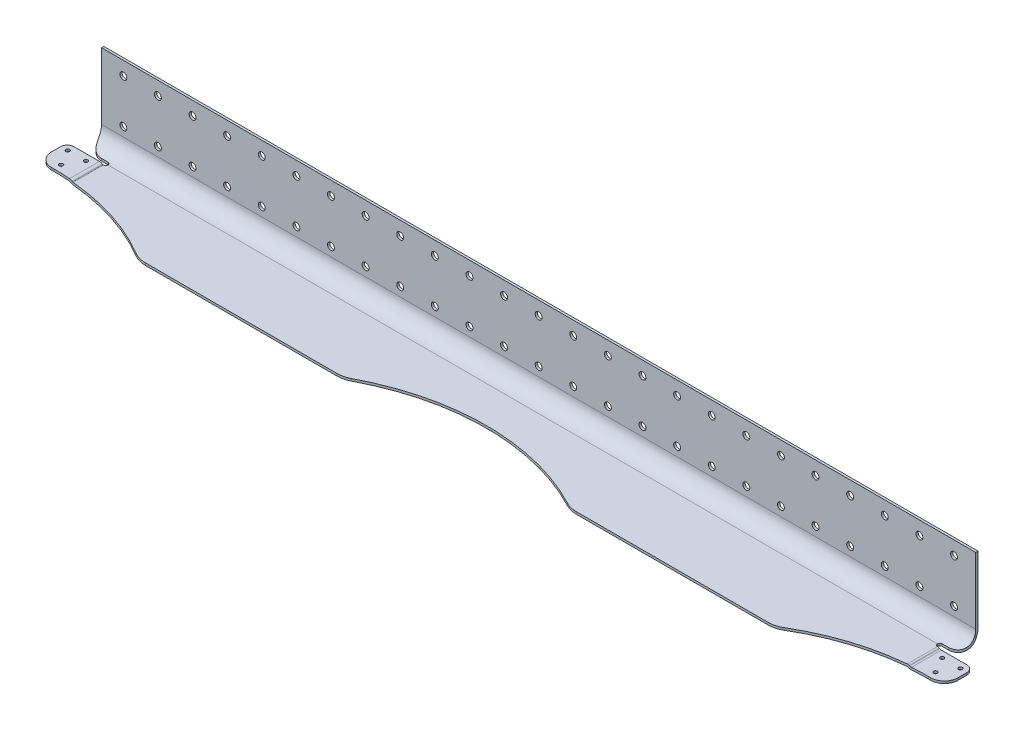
SolidWorks part; units mm, degrees
ref_plane "Front Plane" through (0, 0, 0) normal (1, 0, 0) x (0, 1, 0)
ref_plane "Top Plane" through (0, 0, 0) normal (0, 0, 1) x (0, 1, 0)
ref_plane "Right Plane" through (0, 0, 0) normal (0, 1, 0) x (-1, 0, 0)
sketch "sk 5dia hole pat" plane through (0, 0, 0) normal (0, 0, 1) x (0, 1, 0)
  line L4 (-30.48, -48.26) -> (30.48, -48.26) construction
  point P3 (0, -48.26)
  circle B0 centre (30.48, -579.12) radius 4.826
  circle B1 centre (1188.72, 579.12) radius 4.826
  circle B2 centre (78.74, -579.12) radius 4.826
  circle B3 centre (127, -579.12) radius 4.826
  circle B4 centre (175.26, -579.12) radius 4.826
  circle B5 centre (223.52, -579.12) radius 4.826
  circle B6 centre (271.78, -579.12) radius 4.826
  circle B7 centre (320.04, -579.12) radius 4.826
  circle B8 centre (368.3, -579.12) radius 4.826
  circle B9 centre (416.56, -579.12) radius 4.826
  circle B10 centre (464.82, -579.12) radius 4.826
  circle B11 centre (513.08, -579.12) radius 4.826
  circle B12 centre (561.34, -579.12) radius 4.826
  circle B13 centre (609.6, -579.12) radius 4.826
  circle B14 centre (657.86, -579.12) radius 4.826
  circle B15 centre (706.12, -579.12) radius 4.826
  circle B16 centre (754.38, -579.12) radius 4.826
  circle B17 centre (802.64, -579.12) radius 4.826
  circle B18 centre (850.9, -579.12) radius 4.826
  circle B19 centre (899.16, -579.12) radius 4.826
  circle B20 centre (947.42, -579.12) radius 4.826
  circle B21 centre (995.68, -579.12) radius 4.826
  circle B22 centre (1043.94, -579.12) radius 4.826
  circle B23 centre (1092.2, -579.12) radius 4.826
  circle B24 centre (1140.46, -579.12) radius 4.826
  circle B25 centre (1188.72, -579.12) radius 4.826
  circle B26 centre (30.48, -530.86) radius 4.826
  circle B27 centre (30.48, -482.6) radius 4.826
  circle B28 centre (30.48, -434.34) radius 4.826
  circle B29 centre (30.48, -386.08) radius 4.826
  circle B30 centre (30.48, -337.82) radius 4.826
  circle B31 centre (30.48, -289.56) radius 4.826
  circle B32 centre (30.48, -241.3) radius 4.826
  circle B33 centre (30.48, -193.04) radius 4.826
  circle B34 centre (30.48, -144.78) radius 4.826
  circle B35 centre (30.48, -96.52) radius 4.826
  circle B36 centre (30.48, -48.26) radius 4.826
  circle B37 centre (30.48, 0) radius 4.826
  circle B38 centre (30.48, 48.26) radius 4.826
  circle B39 centre (30.48, 96.52) radius 4.826
  circle B40 centre (30.48, 144.78) radius 4.826
  circle B41 centre (30.48, 193.04) radius 4.826
  circle B42 centre (30.48, 241.3) radius 4.826
  circle B43 centre (30.48, 289.56) radius 4.826
  circle B44 centre (30.48, 337.82) radius 4.826
  circle B45 centre (30.48, 386.08) radius 4.826
  circle B46 centre (30.48, 434.34) radius 4.826
  circle B47 centre (30.48, 482.6) radius 4.826
  circle B48 centre (30.48, 530.86) radius 4.826
  circle B49 centre (30.48, 579.12) radius 4.826
  circle B50 centre (1140.46, 579.12) radius 4.826
  circle B51 centre (1092.2, 579.12) radius 4.826
  circle B52 centre (1043.94, 579.12) radius 4.826
  circle B53 centre (995.68, 579.12) radius 4.826
  circle B54 centre (947.42, 579.12) radius 4.826
  circle B55 centre (899.16, 579.12) radius 4.826
  circle B56 centre (850.9, 579.12) radius 4.826
  circle B57 centre (802.64, 579.12) radius 4.826
  circle B58 centre (754.38, 579.12) radius 4.826
  circle B59 centre (706.12, 579.12) radius 4.826
  circle B60 centre (657.86, 579.12) radius 4.826
  circle B61 centre (609.6, 579.12) radius 4.826
  circle B62 centre (561.34, 579.12) radius 4.826
  circle B63 centre (513.08, 579.12) radius 4.826
  circle B64 centre (464.82, 579.12) radius 4.826
  circle B65 centre (416.56, 579.12) radius 4.826
  circle B66 centre (368.3, 579.12) radius 4.826
  circle B67 centre (320.04, 579.12) radius 4.826
  circle B68 centre (271.78, 579.12) radius 4.826
  circle B69 centre (223.52, 579.12) radius 4.826
  circle B70 centre (175.26, 579.12) radius 4.826
  circle B71 centre (127, 579.12) radius 4.826
  circle B72 centre (78.74, 579.12) radius 4.826
  circle B73 centre (1188.72, 530.86) radius 4.826
  circle B74 centre (1188.72, 482.6) radius 4.826
  circle B75 centre (1188.72, 434.34) radius 4.826
  circle B76 centre (1188.72, 386.08) radius 4.826
  circle B77 centre (1188.72, 337.82) radius 4.826
  circle B78 centre (1188.72, 289.56) radius 4.826
  circle B79 centre (1188.72, 241.3) radius 4.826
  circle B80 centre (1188.72, 193.04) radius 4.826
  circle B81 centre (1188.72, 144.78) radius 4.826
  circle B82 centre (1188.72, 96.52) radius 4.826
  circle B83 centre (1188.72, 48.26) radius 4.826
  circle B84 centre (1188.72, 0) radius 4.826
  circle B85 centre (1188.72, -48.26) radius 4.826
  circle B86 centre (1188.72, -96.52) radius 4.826
  circle B87 centre (1188.72, -144.78) radius 4.826
  circle B88 centre (1188.72, -193.04) radius 4.826
  circle B89 centre (1188.72, -241.3) radius 4.826
  circle B90 centre (1188.72, -289.56) radius 4.826
  circle B91 centre (1188.72, -337.82) radius 4.826
  circle B92 centre (1188.72, -386.08) radius 4.826
  circle B93 centre (1188.72, -434.34) radius 4.826
  circle B94 centre (1188.72, -482.6) radius 4.826
  circle B95 centre (1188.72, -530.86) radius 4.826
  line B96 (609.6, -579.12) -> (609.6, -504.12) construction
  line B97 (30.48, 0) -> (105.48, 0) construction
  circle B98 centre (-30.48, 579.12) radius 4.826
  circle B99 centre (-175.26, -579.12) radius 4.826
  circle B100 centre (-127, -579.12) radius 4.826
  circle B101 centre (-30.48, -579.12) radius 4.826
  circle B102 centre (-1188.72, 96.52) radius 4.826
  circle B103 centre (-127, 579.12) radius 4.826
  circle B104 centre (-464.82, 579.12) radius 4.826
  circle B105 centre (-513.08, 579.12) radius 4.826
  circle B106 centre (-706.12, 579.12) radius 4.826
  circle B107 centre (-754.38, 579.12) radius 4.826
  circle B108 centre (-899.16, 579.12) radius 4.826
  circle B109 centre (-30.48, 530.86) radius 4.826
  circle B110 centre (-30.48, 482.6) radius 4.826
  circle B111 centre (-30.48, 434.34) radius 4.826
  circle B112 centre (-30.48, 386.08) radius 4.826
  circle B113 centre (-30.48, 337.82) radius 4.826
  circle B114 centre (-30.48, 289.56) radius 4.826
  circle B115 centre (-30.48, 241.3) radius 4.826
  circle B116 centre (-30.48, 193.04) radius 4.826
  circle B117 centre (-30.48, 144.78) radius 4.826
  circle B118 centre (-30.48, 96.52) radius 4.826
  circle B119 centre (-30.48, 48.26) radius 4.826
  circle B120 centre (-30.48, 0) radius 4.826
  circle B121 centre (-30.48, -48.26) radius 4.826
  circle B122 centre (-30.48, -96.52) radius 4.826
  circle B123 centre (-30.48, -144.78) radius 4.826
  circle B124 centre (-30.48, -241.3) radius 4.826
  circle B125 centre (-30.48, -289.56) radius 4.826
  circle B126 centre (-30.48, -337.82) radius 4.826
  circle B127 centre (-30.48, -386.08) radius 4.826
  circle B128 centre (-30.48, -434.34) radius 4.826
  circle B129 centre (-30.48, -482.6) radius 4.826
  circle B130 centre (-30.48, -530.86) radius 4.826
  line B131 (-1188.72, 0) -> (-1113.72, 0) construction
  dimension "D1" = 60.96
sketch_block_instance "5dia hole pat-1"
sketch_block "5dia hole pat" parameters "D1"=9.652, "D2"=9.652, "D3"=75
sketch_block_instance "5dia hole pat-2"
sketch "sk 47.986in pnl" plane through (0, 0, 0) normal (0, 0, 1) x (0, 1, 0)
  line B0 (0.1778, 0) -> (1219.0222, 0) construction
  line B1 (0.1778, 609.4222) -> (1219.0222, 609.4222)
  line B2 (0.1778, 609.4222) -> (0.1778, -609.4222)
  line B3 (0.1778, -609.4222) -> (1219.0222, -609.4222)
  line B4 (1219.0222, 609.4222) -> (1219.0222, -609.4222)
  line B5 (609.6, 609.4222) -> (609.6, -609.4222) construction
  dimension "D1" = 30.3022
sketch_block_instance "47.986in pnl-1"
sketch_block "47.986in pnl" parameters "D1"=1218.8444, "D2"=1218.8444
sketch "sk main body" plane through (0, 0, 0) normal (1, 0, 0) x (0, 1, 0)
  line L0 (49.53, 0) -> (-43.18, 0)
  line L1 (-68.58, 25.4) -> (-68.58, 158.75)
  line L2 (-43.18, 184.15) -> (-7.62, 184.15)
  line L3 (-26.67, 213.8401) -> (-26.67, 147.2198) construction
  line L4 (49.53, 3.175) -> (-43.18, 3.175)
  line L5 (-65.405, 25.4) -> (-65.405, 158.75)
  line L6 (-43.18, 180.975) -> (-7.62, 180.975)
  line L7 (-7.62, 184.15) -> (-7.62, 180.975)
  line L8 (49.53, 3.175) -> (49.53, 0)
  line L9 (670.3644, 0) -> (-670.3644, 0) construction
  arc A0 (-43.18, 0) -> (-68.58, 25.4) centre (-43.18, 25.4) cw
  arc A1 (-68.58, 158.75) -> (-43.18, 184.15) centre (-43.18, 158.75) cw
  arc A2 (-43.18, 3.175) -> (-65.405, 25.4) centre (-43.18, 25.4) cw
  arc A3 (-65.405, 158.75) -> (-43.18, 180.975) centre (-43.18, 158.75) cw
  dimension "D2" = 25.4
  dimension "D1" = 19.05
  dimension "D3" = 12.7
  dimension "D4" = 16.51
  dimension "D5" = 19.05
  dimension "D7" = 177.8
  dimension "D6" = 3.175
extrude "main body" add sketch "sk main body" along normal mid plane 1218.8444
sketch "sk upper holes" plane through (0, 0, 184.15) normal (0, 0, 1) x (1, 0, 0)
  line L0 (-609.4222, 0.1778) -> (-609.4222, 1219.0222) construction
  line L1 (609.4222, 0.1778) -> (609.4222, 1219.0222) construction
  line L2 (609.4222, -7.62) -> (-609.4222, -7.62) construction
  circle A2 centre (-342.9, -26.67) radius 16.51 construction
  circle A3 centre (-266.7, -26.67) radius 16.51 construction
  circle A4 centre (266.7, -26.67) radius 16.51 construction
  circle A5 centre (342.9, -26.67) radius 16.51 construction
  line B0 (-342.9, -26.67) -> (-266.7, -26.67) construction
  circle B1 centre (-342.9, -26.67) radius 7.1438
  circle B2 centre (-266.7, -26.67) radius 7.1438
  line B3 (266.7, -26.67) -> (342.9, -26.67) construction
  circle B4 centre (266.7, -26.67) radius 7.1438
  circle B5 centre (342.9, -26.67) radius 7.1438
  dimension "D1" = 304.8
  dimension "D2" = 304.8
  dimension "D6" = 33.02
  dimension "D7" = 33.02
  dimension "D8" = 33.02
  dimension "D9" = 33.02
  dimension "D3" = 304.6222
  dimension "D4" = 304.6222
  dimension "D5" = 19.05
sketch_block_instance "Upper bolt holes-1"
sketch_block "Upper bolt holes" parameters "D1"=14.2875, "D2"=14.2875, "D3"=76.2
sketch_block_instance "Upper bolt holes-2"
sketch "Sketch6" plane through (0, 0, 184.15) normal (0, 0, 1) x (1, 0, 0)
  line L0 (-371.4962, -43.18) -> (-304.8, 72.3411)
  line L1 (609.4222, -43.18) -> (-609.4222, -43.18) construction
  line L2 (-304.8, 72.3411) -> (-238.1038, -43.18)
  line L3 (-371.4962, -43.18) -> (-638.8127, -43.18)
  line L4 (-638.8127, -43.18) -> (-638.8127, 115.8831)
  line L6 (238.1038, -43.18) -> (304.8, 72.3411)
  line L7 (304.8, 72.3411) -> (371.4962, -43.18)
  line L8 (371.4962, -43.18) -> (645.1619, -43.18)
  line L9 (645.1619, -43.18) -> (645.1619, 115.8831)
  line L10 (-238.1038, -43.18) -> (238.1038, -43.18)
  line L11 (-638.8127, 115.8831) -> (645.1619, 115.8831)
  circle A0 centre (-342.9, -26.67) radius 16.51 construction
  circle A1 centre (-266.7, -26.67) radius 16.51 construction
  circle A2 centre (342.9, -26.67) radius 16.51 construction
  circle A3 centre (266.7, -26.67) radius 16.51 construction
  dimension "D1" = 60
  dimension "D2" = 60
  dimension "D3" = 60
  dimension "D4" = 60
extrude "Upper tabs" cut sketch "Sketch6" against normal blind 10
sketch "Sketch7" plane through (0, 0, 0) normal (0, 1, 0) x (-1, 0, 0)
  line L0 (-238.1038, 180.975) -> (-238.1038, 196.2087)
  line L4 (-238.1038, 196.2087) -> (238.1038, 196.2087)
  line L5 (238.1038, 196.2087) -> (238.1038, 180.975)
  line L6 (-609.4222, 25.4) -> (609.4222, 25.4) construction
  arc A2 (-238.1038, 180.975) -> (238.1038, 180.975) centre (0, 399.136) ccw
  point P2 (0, 76.2)
  dimension "D1" = 50.8
extrude "Side Mid curve" cut sketch "Sketch7" against normal through all
sketch "5dia hole for part" plane through (0, 0, 0) normal (0, 0, 1) x (0, 1, 0)
  circle A0 centre (-30.48, -579.12) radius 4.826
  circle A1 centre (30.48, -579.12) radius 4.826
  circle A2 centre (-30.48, -579.12) radius 4.826 construction
  circle A3 centre (30.48, -579.12) radius 4.826 construction
  circle A4 centre (-30.48, -530.86) radius 4.826
  circle A5 centre (30.48, -530.86) radius 4.826
  circle A6 centre (-30.48, -482.6) radius 4.826
  circle A7 centre (30.48, -482.6) radius 4.826
  circle A8 centre (-30.48, -434.34) radius 4.826
  circle A9 centre (30.48, -434.34) radius 4.826
  circle A10 centre (-30.48, -386.08) radius 4.826
  circle A11 centre (30.48, -386.08) radius 4.826
  circle A12 centre (-30.48, -337.82) radius 4.826
  circle A13 centre (30.48, -337.82) radius 4.826
  circle A14 centre (-30.48, -289.56) radius 4.826
  circle A15 centre (30.48, -289.56) radius 4.826
  circle A16 centre (-30.48, -241.3) radius 4.826
  circle A17 centre (30.48, -241.3) radius 4.826
  circle A18 centre (-30.48, -193.04) radius 4.826
  circle A19 centre (30.48, -193.04) radius 4.826
  circle A20 centre (-30.48, -144.78) radius 4.826
  circle A21 centre (30.48, -144.78) radius 4.826
  circle A22 centre (-30.48, -96.52) radius 4.826
  circle A23 centre (30.48, -96.52) radius 4.826
  circle A24 centre (-30.48, -48.26) radius 4.826
  circle A25 centre (30.48, -48.26) radius 4.826
  circle A26 centre (-30.48, 0) radius 4.826
  circle A27 centre (30.48, 0) radius 4.826
  circle A28 centre (-30.48, 48.26) radius 4.826
  circle A29 centre (30.48, 48.26) radius 4.826
  circle A30 centre (-30.48, 96.52) radius 4.826
  circle A31 centre (30.48, 96.52) radius 4.826
  circle A32 centre (-30.48, 144.78) radius 4.826
  circle A33 centre (30.48, 144.78) radius 4.826
  circle A34 centre (-30.48, 193.04) radius 4.826
  circle A35 centre (30.48, 193.04) radius 4.826
  circle A36 centre (-30.48, 241.3) radius 4.826
  circle A37 centre (30.48, 241.3) radius 4.826
  circle A38 centre (-30.48, 289.56) radius 4.826
  circle A39 centre (30.48, 289.56) radius 4.826
  circle A40 centre (-30.48, 337.82) radius 4.826
  circle A41 centre (30.48, 337.82) radius 4.826
  circle A42 centre (-30.48, 386.08) radius 4.826
  circle A43 centre (30.48, 386.08) radius 4.826
  circle A44 centre (-30.48, 434.34) radius 4.826
  circle A45 centre (30.48, 434.34) radius 4.826
  circle A46 centre (-30.48, 482.6) radius 4.826
  circle A47 centre (30.48, 482.6) radius 4.826
  circle A48 centre (-30.48, 530.86) radius 4.826
  circle A49 centre (30.48, 530.86) radius 4.826
  circle A50 centre (-30.48, 579.12) radius 4.826
  circle A51 centre (30.48, 579.12) radius 4.826
  dimension "D1" = 25
extrude "Holes Bot" cut sketch "5dia hole for part" along normal blind 10
extrude "Holes Top" cut sketch "sk upper holes" against normal blind 10
ref_plane "Tab Lower pln" through (0, 0, 25.4) normal (0, 0, 1) x (0, 1, 0)
sketch "sk Rivet holes" plane through (0, 0, 0) normal (0, 1, 0) x (-1, 0, 0)
  line L1 (609.4222, 0) -> (609.4222, 3.175) construction
  line L3 (64.9605, 25.4) -> (-64.9605, 25.4) construction
  line L5 (-609.4222, 25.4) -> (-609.4222, 158.75) construction
  circle A0 centre (622.3, 37.4) radius 10 construction
  circle A1 centre (609.6, 59.397) radius 10 construction
  circle A2 centre (596.9, 37.4) radius 10 construction
  circle A3 centre (-609.6, 59.397) radius 10 construction
  circle A4 centre (-596.9, 37.4) radius 10 construction
  circle A6 centre (-622.3, 37.4) radius 10 construction
  point P5 (622.3, 34.8092)
  point P9 (622.3, 27.4)
  point P20 (632.3, 37.4)
  point P21 (-632.3, 37.4)
  point P22 (586.9, 37.4)
  point P23 (-586.9, 37.4)
  point P24 (609.6, 69.397)
  point P25 (-609.6, 69.397)
  line B0 (596.9, 37.4) -> (609.6, 59.397) construction
  line B1 (609.6, 59.397) -> (622.3, 37.4) construction
  line B2 (622.3, 37.4) -> (596.9, 37.4) construction
  circle B3 centre (596.9, 37.4) radius 2.5908
  circle B4 centre (622.3, 37.4) radius 2.5908
  circle B5 centre (609.6, 59.397) radius 2.5908
  line B6 (603.25, 48.3985) -> (609.6, 44.7323) construction
  line B7 (609.6, 37.4) -> (609.6, 44.7323) construction
  line B8 (-622.3, 37.4) -> (-609.6, 59.397) construction
  line B9 (-609.6, 59.397) -> (-596.9, 37.4) construction
  line B10 (-596.9, 37.4) -> (-622.3, 37.4) construction
  circle B11 centre (-622.3, 37.4) radius 2.5908
  circle B12 centre (-596.9, 37.4) radius 2.5908
  circle B13 centre (-609.6, 59.397) radius 2.5908
  line B14 (-615.95, 48.3985) -> (-609.6, 44.7323) construction
  line B15 (-609.6, 37.4) -> (-609.6, 44.7323) construction
  dimension "D4" = 20
  dimension "D6" = 20
  dimension "D7" = 20
  dimension "D8" = 20
  dimension "D9" = 20
  dimension "D10" = 20
  dimension "D1" = 0.1778
  dimension "D2" = 12
  dimension "D3" = 0.1778
  dimension "D5" = 7.4092
sketch_block_instance "Blind Rivet holes-1"
sketch_block "Blind Rivet holes" parameters "D1"=5.1816, "D2"=5.1816, "D3"=5.1816, "D4"=60, "D5"=60, "D6"=25.4, "D7"=25.4, "D8"=25.4
sketch_block_instance "Blind Rivet holes-2"
sketch "sk Vtab" plane through (0, 0, 25.4) normal (0, 0, 1) x (0, 1, 0)
  line L8 (-68.58, -609.4222) -> (-68.58, 609.4222) construction
  line B0 (-68.58, 579.4709) -> (-68.58, 581.4709)
  line B1 (-67.9101, 583.9709) -> (-67.6624, 584.4)
  line B2 (-66.9925, 586.9) -> (-66.9925, 631.9)
  line B3 (-65.405, 579.4709) -> (-65.405, 581.4709)
  line B4 (-65.1605, 582.3834) -> (-64.9127, 582.8125)
  line B5 (-63.8175, 586.9) -> (-63.8175, 631.9)
  line B6 (-68.58, 579.4709) -> (-65.405, 579.4709)
  line B7 (-63.8175, 631.9) -> (-66.9925, 631.9)
  arc B8 (-67.6624, 584.4) -> (-66.9925, 586.9) centre (-71.9925, 586.9) ccw
  arc B9 (-68.58, 581.4709) -> (-67.9101, 583.9709) centre (-63.58, 581.4709) cw
  arc B10 (-65.405, 581.4709) -> (-65.1605, 582.3834) centre (-63.58, 581.4709) cw
  arc B11 (-64.9127, 582.8125) -> (-63.8175, 586.9) centre (-71.9925, 586.9) ccw
  line B12 (-65.405, -579.4709) -> (-65.405, -581.4709)
  line B13 (-66.0749, -583.9709) -> (-66.3226, -584.4)
  line B14 (-66.9925, -586.9) -> (-66.9925, -631.9)
  line B15 (-68.58, -579.4709) -> (-68.58, -581.4709)
  line B16 (-68.8245, -582.3834) -> (-69.0723, -582.8125)
  line B17 (-70.1675, -586.9) -> (-70.1675, -631.9)
  line B18 (-65.405, -579.4709) -> (-68.58, -579.4709)
  line B19 (-70.1675, -631.9) -> (-66.9925, -631.9)
  arc B20 (-66.3226, -584.4) -> (-66.9925, -586.9) centre (-61.9925, -586.9) ccw
  arc B21 (-65.405, -581.4709) -> (-66.0749, -583.9709) centre (-70.405, -581.4709) cw
  arc B22 (-68.58, -581.4709) -> (-68.8245, -582.3834) centre (-70.405, -581.4709) cw
  arc B23 (-69.0723, -582.8125) -> (-70.1675, -586.9) centre (-61.9925, -586.9) ccw
sketch_block_instance "V tab-1"
sketch_block "V tab" parameters "D3"=5, "D1"=30, "D2"=1.5875, "D4"=2, "D5"=24.625
sketch_block_instance "V tab-2"
sketch "sk Vtab precut" plane through (0, 0, 25.4) normal (0, 0, 1) x (0, 1, 0)
  line L1 (-68.58, 581.4709) -> (-25.5629, 581.4709)
  line L2 (-68.58, 581.4709) -> (-68.58, 628.7058)
  line L3 (-68.58, 628.7058) -> (-25.5629, 628.7058)
  line L4 (-25.5629, 581.4709) -> (-25.5629, 628.7058)
  line L5 (-68.58, -581.4709) -> (-35.8904, -581.4709)
  line L6 (-68.58, -581.4709) -> (-68.58, -622.8382)
  line L7 (-68.58, -622.8382) -> (-35.8904, -622.8382)
  line L8 (-35.8904, -581.4709) -> (-35.8904, -622.8382)
sketch "Sketch9" plane through (0, 0, 0) normal (0, 1, 0) x (-1, 0, 0)
  line L6 (371.4962, 180.975) -> (371.4962, 193.3104)
  line L7 (371.4962, 193.3104) -> (736.1624, 193.3104)
  line L8 (736.1624, 193.3104) -> (736.1624, 69.397)
  line L9 (736.1624, 69.397) -> (609.6, 69.397)
  line L10 (-371.4962, 180.975) -> (-371.4962, 190.6931)
  line L11 (-371.4962, 190.6931) -> (-686.7988, 190.6931)
  line L12 (-686.7988, 190.6931) -> (-686.7988, 69.397)
  line L13 (-686.7988, 69.397) -> (-609.6, 69.397)
  arc A2 (371.4962, 180.975) -> (609.6, 69.397) centre (609.6, 379.2391) ccw
  arc A3 (-371.4962, 180.975) -> (-609.6, 69.397) centre (-609.6, 379.2391) cw
  circle A4 centre (-609.6, 59.397) radius 10 construction
extrude "Cut-Extrude5" cut sketch "sk Vtab precut" along normal through all
extrude "Side Tabs" add sketch "sk Vtab" along normal blind 50
sketch "Sketch11" plane through (0, 0, 0) normal (0, 1, 0) x (-1, 0, 0)
  line L0 (581.4709, 25.4) -> (667.6325, 25.4) construction
  line L1 (581.4709, 28.575) -> (667.6325, 28.575)
  line L2 (581.4709, 22.225) -> (667.6325, 22.225)
  line L4 (-581.4709, 25.4) -> (581.4709, 25.4) construction
  line L5 (581.4709, 75.4) -> (581.4709, 25.4) construction
  line L6 (-581.4709, 25.4) -> (-658.6998, 25.4) construction
  line L7 (-581.4709, 22.225) -> (-658.6998, 22.225)
  line L8 (-581.4709, 28.575) -> (-658.6998, 28.575)
  line L9 (-581.4709, 25.4) -> (-581.4709, 75.4) construction
  arc A0 (581.4709, 28.575) -> (581.4709, 22.225) centre (581.4709, 25.4) ccw
  arc A1 (667.6325, 22.225) -> (667.6325, 28.575) centre (667.6325, 25.4) ccw
  arc A2 (-581.4709, 22.225) -> (-581.4709, 28.575) centre (-581.4709, 25.4) ccw
  arc A3 (-658.6998, 28.575) -> (-658.6998, 22.225) centre (-658.6998, 25.4) ccw
  point P2 (624.5517, 25.4)
  point P7 (-620.0853, 25.4)
  dimension "D1" = 3.175
  dimension "D2" = 3.175
extrude "tab undercut" cut sketch "Sketch11" against normal through all
extrude "Outer curve cut" cut sketch "Sketch9" against normal through all
fillet "Fillet1" radius 19.05 12 edges at (-609.4222, -66.7789, 22.225) (609.4222, -66.7789, 22.225) (631.9, -68.58, 69.397) (-631.9, -65.405, 69.397) (-371.4962, -49.3284, 180.975) (-238.1038, -49.3284, 180.975) (371.4962, -49.3284, 180.975) (238.1038, -49.3284, 180.975) (350.9656, -7.62, 182.5625) (258.6344, -7.62, 182.5625) (-258.6344, -7.62, 182.5625) (-350.9656, -7.62, 182.5625)
fillet "Fillet3" radius 9.525 6 edges at (631.9, -68.58, 28.575) (-631.9, -65.405, 28.575) (237.1094, -44.9024, 182.4383) (372.3141, -44.5968, 182.4697) (-237.1094, -44.9024, 182.4383) (-372.3141, -44.5968, 182.4697)
extrude "Tab Holes" cut sketch "sk Rivet holes" against normal through all
sketch "Sketch12" plane through (0, 0, 0) normal (0, 1, 0) x (-1, 0, 0)
  line L0 (-578.2959, 25.4) -> (578.2959, 25.4) construction
  line L1 (-521.5573, 226.8795) -> (537.0245, 226.8795)
  line L2 (-521.5573, 226.8795) -> (-521.5573, 117.475)
  line L3 (-521.5573, 117.475) -> (537.0245, 117.475)
  line L4 (537.0245, 226.8795) -> (537.0245, 117.475)
  point P6 (7.7336, 117.475)
  dimension "D1" = 92.075
extrude "Cut-Extrude6" cut sketch "Sketch12" against normal through all both and the other way through all
fillet "Fillet4" radius 35 4 edges at (-443.8241, -66.9925, 117.475) (-157.9707, -66.9925, 117.475) (157.9707, -66.9925, 117.475) (443.8241, -66.9925, 117.475)
equation "\"3i\"=138.375"
equation "\".75i\"=12.7"
